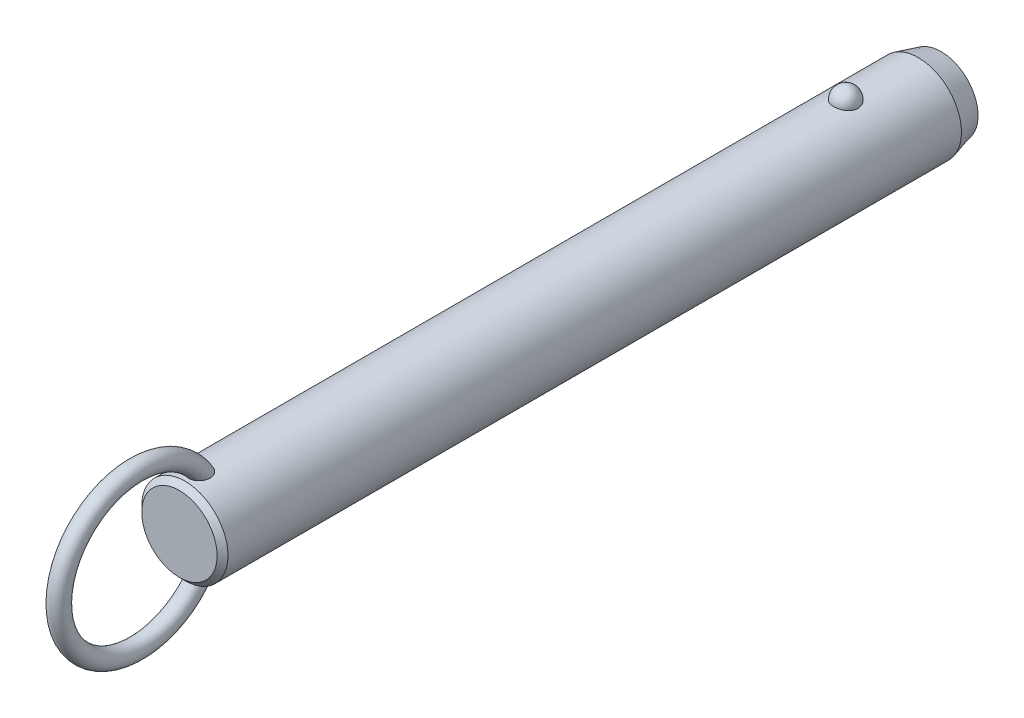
SolidWorks part; units mm, degrees
ref_plane "Front Plane" through (0, 0, 0) normal (0, 0, 1) x (1, 0, 0)
ref_plane "Top Plane" through (0, 0, 0) normal (0, 1, 0) x (1, 0, 0)
ref_plane "Right Plane" through (0, 0, 0) normal (1, 0, 0) x (0, 0, -1)
sketch "Sketch2" plane through (0, 0, 0) normal (0, 0, 1) x (1, 0, 0)
  circle A0 centre (0, 0) radius 9.5
  point P3 (0, 9.5)
  dimension "D1" = 19
extrude "Boss-Extrude1" add sketch "Sketch2" along normal blind 134.6
sketch "Sketch3" plane through (0, 0, 0) normal (0, 0, -1) x (-1, 0, 0)
  circle A0 centre (0, 0) radius 9.5
  dimension "D1" = 19
extrude "Boss-Extrude2" add sketch "Sketch3" along normal blind 23.7
chamfer "Chamfer1" distance 5 angle 15 1 edges at (-9.5, 0, -23.7)
sketch "Sketch12" plane through (0, 0, 0) normal (1, 0, 0) x (0, 0, -1)
  line L0 (-134.6, 9.5) -> (-134.6, -9.5) construction
  point P0 (-134.6, 0)
sketch "Sketch13" plane through (0, 0, 0) normal (1, 0, 0) x (0, 0, -1)
  circle A0 centre (-153.65, 0) radius 19.05
  point P2 (-134.6, 0)
  dimension "D1" = 38.1
sketch "Sketch14" plane through (0, 0, 0) normal (0, 1, 0) x (1, 0, 0)
  circle A0 centre (0, -136.6) radius 2
  point P2 (0, -134.6)
  dimension "D1" = 4
sweep "Sweep1" add profiles "Sketch14" path "Sketch13"
sketch "Sketch15" plane through (0, 0, 134.6) normal (0, 0, 1) x (1, 0, 0)
  circle A0 centre (0, 0) radius 9.5
  dimension "D1" = 19
extrude "Boss-Extrude3" add sketch "Sketch15" along normal blind 9.52
chamfer "Chamfer2" distance 1.2 angle 45 1 edges at (9.5, 0, 144.12)
sketch "Sketch18" plane through (0, 0, 0) normal (1, 0, 0) x (0, 0, -1)
  line L0 (18.7, 9.5) -> (-137.1378, 9.5) construction
  line L1 (2.7, 12.2) -> (2.7, 6.8)
  line L2 (-137.1378, -9.5) -> (18.7, -9.5) construction
  arc A0 (2.7, 12.2) -> (2.7, 6.8) centre (2.7, 9.5) ccw
  point P4 (0, 9.5)
  dimension "D1" = 21.7
revolve "Revolve1" add sketch "Sketch18" angle 360 about L1
